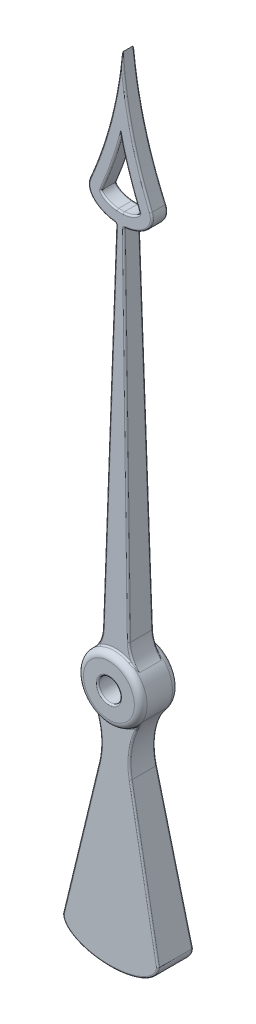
SolidWorks part; units mm, degrees
ref_plane "Спереди" through (0, 0, 0) normal (0, 0, 1) x (1, 0, 0)
ref_plane "Сверху" through (0, 0, 0) normal (0, 1, 0) x (1, 0, 0)
ref_plane "Справа" through (0, 0, 0) normal (1, 0, 0) x (0, 0, -1)
sketch "Эскиз1" plane through (0, 0, 0) normal (0, 0, 1) x (1, 0, 0)
  line L0 (0, 172) -> (0, -75.5) construction
  line L1 (0, 0) -> (-4.5, 0) construction
  line L2 (-15, -68.5) -> (-5.0222, -22.9348)
  line L3 (15, -68.5) -> (5.0222, -22.9348)
  line L4 (-4.5, -18.1087) -> (0, -18.1087) construction
  line L5 (-8.3109, -5.5614) -> (8.3109, -5.5614) construction
  line L6 (-1.2284, 125.0492) -> (-4.1366, 13.8895)
  line L7 (1.2284, 125.0492) -> (4.1366, 13.8895)
  arc A0 (8.3109, -5.5614) -> (7.0666, 7.0755) centre (0, 0) ccw
  circle A1 centre (0, 0) radius 3.5
  arc A2 (-7.0666, 7.0755) -> (-8.3109, -5.5614) centre (0, 0) ccw
  arc A3 (-9.6348, 133.2407) -> (0, 172) centre (-124.5676, 182.3877) ccw
  arc A4 (9.6348, 133.2407) -> (0, 172) centre (124.5676, 182.3877) cw
  arc A5 (5.9569, 131.668) -> (0, 148.863) centre (124.5676, 182.3877) cw
  arc A6 (-5.9569, 131.668) -> (0, 148.863) centre (-124.5676, 182.3877) ccw
  arc A7 (-5.0222, -22.9348) -> (-8.3109, -5.5614) centre (-27.0614, -18.1087) ccw
  arc A8 (5.0222, -22.9348) -> (8.3109, -5.5614) centre (27.0614, -18.1087) cw
  arc A9 (4.1366, 13.8895) -> (7.0666, 7.0755) centre (14.1332, 14.1511) ccw
  arc A10 (-4.1366, 13.8895) -> (-7.0666, 7.0755) centre (-14.1332, 14.1511) cw
  ellipse E0 centre (0, -68.5) end of major axis (-15, -68.5) minor radius 7 (-15, -68.5) -> (15, -68.5) ccw
  ellipse E1 centre (0, 131.5) end of major axis (-10, 131.5) minor radius 6.5 (-9.6348, 133.2407) -> (-1.2284, 125.0492) ccw
  ellipse E2 centre (0, 131.5) end of major axis (-10, 131.5) minor radius 6.5 (1.2284, 125.0492) -> (9.6348, 133.2407) ccw
  spline S0 degree 1 poles (0.9076, 129.0363) (5.9569, 131.668) knots 0 0 1 1 construction
  spline S1 degree 1 poles (-5.9569, 131.668) (-0.9076, 129.0363) knots 0 0 1 1 construction
  spline S2 degree 3 poles (0.9076, 129.0363) (1.4176, 129.0774) (2.4617, 129.2364) (3.8079, 129.6601) (4.8792, 130.208) (5.589, 130.7767) (5.9296, 131.232) (6.003, 131.4576) (6.0009, 131.5034) (5.9951, 131.5629) (5.9699, 131.6375) (5.9569, 131.668) knots 1.693944 1.693944 1.693944 1.693944 1.908788 2.123633 2.338477 2.553321 2.768166 2.98301 3.197855 3.305277 3.412699 3.412699 3.412699 3.412699
  spline S3 degree 3 poles (-5.9569, 131.668) (-5.9699, 131.6375) (-5.9951, 131.5629) (-6.0009, 131.5034) (-6.003, 131.4576) (-5.9296, 131.232) (-5.589, 130.7767) (-4.8792, 130.208) (-3.8079, 129.6601) (-2.4617, 129.2364) (-1.4176, 129.0774) (-0.9076, 129.0363) knots -0.271107 -0.271107 -0.271107 -0.271107 -0.163684 -0.056262 0.158582 0.373427 0.588271 0.803116 1.01796 1.232805 1.447649 1.447649 1.447649 1.447649
  spline S4 degree 2 poles (-1.2284, 125.0492) (0, 124.9508) (1.2284, 125.0492) knots 0 0 0 1 1 1 construction
  spline S5 degree 1 poles (-0.9088, 129.0364) (0.9088, 129.0364) knots 0 0 1 1 construction
  spline S6 degree 3 poles (-0.9088, 129.0364) (-0.3049, 128.988) (0.3049, 128.988) (0.9088, 129.0364) knots 0 0 0 0 1 1 1 1
  point P50 (4.2633, 9.0457)
  point P53 (-4.2633, 9.0457)
  dimension "D1" = 20
  dimension "D2" = 7
  dimension "D11" = 250
  dimension "D14" = 45.1227
  dimension "D16" = 10
  dimension "D3" = 75.5
  dimension "D4" = 172
  dimension "D5" = 14
  dimension "D6" = 30
  dimension "D7" = 9
  dimension "D8" = 20
  dimension "D9" = 13
  dimension "D10" = 40.5
  dimension "D15" = 9
  dimension "D12" = 4
  dimension "D13" = 4
sketch "Эскиз2" plane through (0, 0, 0) normal (0, 0, 1) x (1, 0, 0)
  circle A0 centre (0, 0) radius 10
  arc A1 (-7.0666, 7.0755) -> (-8.3109, -5.5614) centre (0, 0) ccw construction
extrude "Бобышка-Вытянуть1" add sketch "Эскиз2" along normal mid plane 12
fillet "Скругление1" radius 2 2 edges at (10, 0, -6) (10, 0, 6)
sketch "Эскиз3" plane through (0, 0, 0) normal (0, 0, 1) x (1, 0, 0)
  line L0 (1.2284, 125.0492) -> (4.1366, 13.8895) construction
  line L1 (-1.2284, 125.0492) -> (-4.1366, 13.8895) construction
  line L2 (1.2284, 125.0492) -> (4.5, 0)
  line L3 (-1.2284, 125.0492) -> (-4.5, 0)
  line L4 (-4.5, 0) -> (4.5, 0)
  arc A0 (0, 172) -> (9.6348, 133.2407) centre (124.5676, 182.3877) ccw construction
  arc A1 (-9.6348, 133.2407) -> (0, 172) centre (-124.5676, 182.3877) ccw construction
  arc A2 (-5.9569, 131.668) -> (0, 148.863) centre (-124.5676, 182.3877) ccw construction
  arc A3 (0, 148.863) -> (5.9569, 131.668) centre (124.5676, 182.3877) ccw construction
  arc A4 (0, 172) -> (9.6348, 133.2407) centre (124.5676, 182.3877) ccw
  arc A5 (-9.6348, 133.2407) -> (0, 172) centre (-124.5676, 182.3877) ccw
  arc A6 (-5.9569, 131.668) -> (0, 148.863) centre (-124.5676, 182.3877) ccw
  arc A7 (0, 148.863) -> (5.9569, 131.668) centre (124.5676, 182.3877) ccw
  ellipse E0 centre (0, 131.5) end of major axis (-10, 131.5) minor radius 6.5 (-9.6348, 133.2407) -> (-1.2284, 125.0492) ccw construction
  ellipse E1 centre (0, 131.5) end of major axis (-10, 131.5) minor radius 6.5 (1.2284, 125.0492) -> (9.6348, 133.2407) ccw construction
  ellipse E2 centre (0, 131.5) end of major axis (-10, 131.5) minor radius 6.5 (-9.6348, 133.2407) -> (-1.2284, 125.0492) ccw
  ellipse E3 centre (0, 131.5) end of major axis (-10, 131.5) minor radius 6.5 (1.2284, 125.0492) -> (9.6348, 133.2407) ccw
  spline S0 degree 3 poles (-537.0571, -1796.5055) (7.5586, 160.0296) (-5.9268, 132.2626) (-6.0009, 131.5034) (-6.003, 131.4576) (-5.9296, 131.232) (-5.589, 130.7767) (-4.8792, 130.208) (-3.8079, 129.6601) (12.9139, 124.3979) (77.4073, 159.8332) (-1951.529, 568.8561) knots -5.328355 -5.328355 -5.328355 -5.328355 -0.163684 -0.056262 0.158582 0.373427 0.588271 0.803116 1.01796 1.232805 8.809238 8.809238 8.809238 8.809238 only from (-5.9569, 131.668) to (-0.9076, 129.0363) construction
  spline S2 degree 3 poles (1942.2237, 584.9223) (-2078.2142, -22.9706) (2078.191, -22.9739) (-1942.1584, 584.9125) knots -55.533481 -55.533481 -55.533481 -55.533481 56.532875 56.532875 56.532875 56.532875 only from (-0.9088, 129.0364) to (0.9088, 129.0364) construction
  spline S3 degree 3 poles (-5.9569, 131.668) (-5.9699, 131.6375) (-5.9951, 131.5629) (-6.0009, 131.5034) (-6.003, 131.4576) (-5.9296, 131.232) (-5.589, 130.7767) (-4.8792, 130.208) (-3.8079, 129.6601) (-2.4594, 129.2357) (-1.4122, 129.0766) (-0.8997, 129.0357) knots -0.271107 -0.271107 -0.271107 -0.271107 -0.163684 -0.056262 0.158582 0.373427 0.588271 0.803116 1.01796 1.232805 1.448754 1.448754 1.448754 1.448754
  spline S4 degree 3 poles (1951.5726, 568.8649) (-77.4082, 159.8337) (-12.914, 124.3978) (3.8079, 129.6601) (4.8792, 130.208) (5.589, 130.7767) (5.9296, 131.232) (6.003, 131.4576) (6.0009, 131.5034) (5.9268, 132.2626) (-7.5584, 160.0292) (537.0453, -1796.4632) knots -5.6677 -5.6677 -5.6677 -5.6677 1.908788 2.123633 2.338477 2.553321 2.768166 2.98301 3.197855 3.305277 8.46991 8.46991 8.46991 8.46991 only from (0.9076, 129.0363) to (5.9569, 131.668) construction
  spline S5 degree 3 poles (-0.91, 129.0365) (-0.3028, 128.9878) (0.3103, 128.988) (0.9174, 129.0371) knots -0.000685 -0.000685 -0.000685 -0.000685 1.004756 1.004756 1.004756 1.004756
  spline S6 degree 3 poles (0.8962, 129.0354) (1.4098, 129.0762) (2.4584, 129.2354) (3.8079, 129.6601) (4.8792, 130.208) (5.589, 130.7767) (5.9296, 131.232) (6.003, 131.4576) (6.0009, 131.5034) (5.9951, 131.5629) (5.9699, 131.6375) (5.9569, 131.668) knots 1.692349 1.692349 1.692349 1.692349 1.908788 2.123633 2.338477 2.553321 2.768166 2.98301 3.197855 3.305277 3.412699 3.412699 3.412699 3.412699
extrude "Бобышка-Вытянуть2" add sketch "Эскиз3" along normal mid plane 8 separate body contours L2 E3 A4 A5 E2 L3 L4 S6 S5 S3 A6 A7
sketch "Эскиз5" plane through (0, 0, 0) normal (1, 0, 0) x (0, 0, -1)
  line L0 (4, 0) -> (-4, 0)
  line L1 (-4, -10) -> (-4, 10) construction
  line L2 (-4, 0) -> (-2, 172)
  line L3 (-4, 172) -> (4, 172) construction
  line L4 (-2, 172) -> (2, 172)
  line L5 (0, 0) -> (0, 172) construction
  line L6 (4, 0) -> (2, 172)
  dimension "D1" = 4
extrude "Вырез-Вытянуть1" cut sketch "Эскиз5" against normal mid plane 20 flip side to cut
combine bodies "Соединить1" operation type add bodies to combine 103 101
fillet "Скругление2" radius 10 2 edges at (-4.2633, 9.0457, 0) (4.2633, 9.0457, 0)
fillet "Скругление3" radius 0.5 31 edges at (0, 10, 3.8837) (0, 10, -3.8837) (-2.6825, 69.4694, -3.1922) (2.6825, 69.4694, -3.1922) (-4.9465, 10.2008, -3.8814) (-4.9465, 10.2008, 3.8814) (4.9465, 10.2008, -3.8814) (4.9465, 10.2008, 3.8814) (0.9174, 129.0371, 0) (-1.2284, 125.0492, 0) (1.2284, 125.0492, 0) (7.9953, 127.5959, 2.5163) (-0.4406, 129.0086, 2.4999) (5.8492, 131.1375, 2.4751) (-5.8609, 131.1554, 2.4749) (2.6825, 69.4694, 3.1922) (-3.2594, 152.2331, 2.2298) (3.2594, 152.2331, 2.2298) (-9.2467, 129.025, 2.4997) (-2.6749, 140.1603, 2.3702) (2.6749, 140.1603, 2.3702) (7.8082, 127.4391, -2.5181) (5.8609, 131.1554, -2.4749) (0.4583, 129.0093, -2.4999) (-5.8649, 131.1615, -2.4749) (3.2594, 152.2331, -2.2298) (-3.2594, 152.2331, -2.2298) (-9.2163, 128.9775, -2.5003) (2.6749, 140.1603, -2.3702) (-2.6749, 140.1603, -2.3702) (-2.6825, 69.4694, 3.1922)
fillet "Скругление4" radius 0.5 6 edges at (6.1223, 7.9068, 3.7743) (6.1223, 7.9068, -3.7743) (0, 10, -3.8837) (-6.1223, 7.9068, -3.7743) (-6.1223, 7.9068, 3.7743) (0, 10, 3.8837)
sketch "Эскиз6" plane through (0, 0, 0) normal (1, 0, 0) x (0, 0, -1)
  line L0 (0, 0) -> (0, -75.5) construction
  line L1 (0, 172) -> (0, -75.5) construction
  line L2 (0, -68.5) -> (0, -75.5) construction
  line L3 (5.75, -75.5) -> (-5.75, -75.5)
  line L4 (-5.75, -75.5) -> (-3.7656, -8.9133)
  line L5 (-3.5, 0) -> (0, 0) construction
  line L7 (6, 0) -> (-6, 0)
  line L8 (-6, 8) -> (-6, -8) construction
  line L9 (5.75, -75.5) -> (3.7656, -8.9133)
  line L11 (0, -5.5614) -> (-4, -5.5614) construction
  line L12 (-4, 7.951) -> (-4, -10) construction
  arc A0 (-3.7656, -8.9133) -> (-6, 0) centre (-20.6534, -8.41) ccw
  arc A1 (3.7656, -8.9133) -> (6, 0) centre (20.6534, -8.41) cw
  point P7 (0, -18.1087)
  dimension "D1" = 7
  dimension "D2" = 11.5
extrude "Бобышка-Вытянуть3" add sketch "Эскиз6" along normal mid plane 30 separate body
sketch "Эскиз7" plane through (0, 0, 0) normal (0, 0, 1) x (1, 0, 0)
  line L0 (-15, -68.5) -> (-5.0222, -22.9348) construction
  line L1 (15, -68.5) -> (5.0222, -22.9348) construction
  line L2 (-15, -68.5) -> (-5.0222, -22.9348)
  line L3 (15, -68.5) -> (5.0222, -22.9348)
  line L5 (-8.3109, -5.5614) -> (8.3109, -5.5614)
  arc A0 (8.3109, -5.5614) -> (5.0222, -22.9348) centre (27.0614, -18.1087) ccw construction
  arc A1 (-5.0222, -22.9348) -> (-8.3109, -5.5614) centre (-27.0614, -18.1087) ccw construction
  arc A4 (8.3109, -5.5614) -> (5.0222, -22.9348) centre (27.0614, -18.1087) ccw
  arc A5 (-5.0222, -22.9348) -> (-8.3109, -5.5614) centre (-27.0614, -18.1087) ccw
  ellipse E0 centre (0, -68.5) end of major axis (15, -68.5) minor radius 7 (-15, -68.5) -> (15, -68.5) ccw construction
  ellipse E1 centre (0, -68.5) end of major axis (15, -68.5) minor radius 7 (-15, -68.5) -> (15, -68.5) ccw
extrude "Вырез-Вытянуть2" cut sketch "Эскиз7" against normal mid plane 20 flip side to cut
combine bodies "Соединить2" operation type add bodies to combine 104 106
fillet "Скругление5" radius 0.5 6 edges at (-6.2883, -7.7754, -3.7701) (0, -10, -3.798) (-5.9935, -8.0048, 3.763) (0, -10, 3.798) (5.9935, -8.0048, -3.763) (6.2883, -7.7754, 3.7701)
fillet "Скругление6" radius 0.5 18 edges at (-4.6175, -15.809, -3.9711) (-4.6175, -15.809, 3.9711) (4.6175, -15.809, -3.9711) (4.6175, -15.809, 3.9711) (0.5057, -75.496, -5.7499) (-0.5057, -75.496, 5.7499) (-10.0111, -45.7174, -4.8624) (-10.0111, -45.7174, 4.8624) (10.0111, -45.7174, -4.8624) (10.0111, -45.7174, 4.8624)
sketch "Эскиз8" plane through (0, 0, 0) normal (0, 0, 1) x (1, 0, 0)
  circle A0 centre (0, 0) radius 3.5 construction
  circle A1 centre (0, 0) radius 3.5
extrude "Вырез-Вытянуть3" cut sketch "Эскиз8" against normal mid plane 20
fillet "Скругление7" radius 0.5 2 edges at (3.5, 0, -6) (3.5, 0, 6)
sketch "Эскиз9" plane through (0, 0, -6) normal (0, 0, -1) x (-1, 0, 0)
  circle A0 centre (0, 0) radius 4.5
  dimension "D1" = 9
extrude "Вырез-Вытянуть4" cut sketch "Эскиз9" against normal blind 2
fillet "Скругление8" radius 0.5 2 edges at (-4.5, 0, -6) (-4.5, 0, -4)
